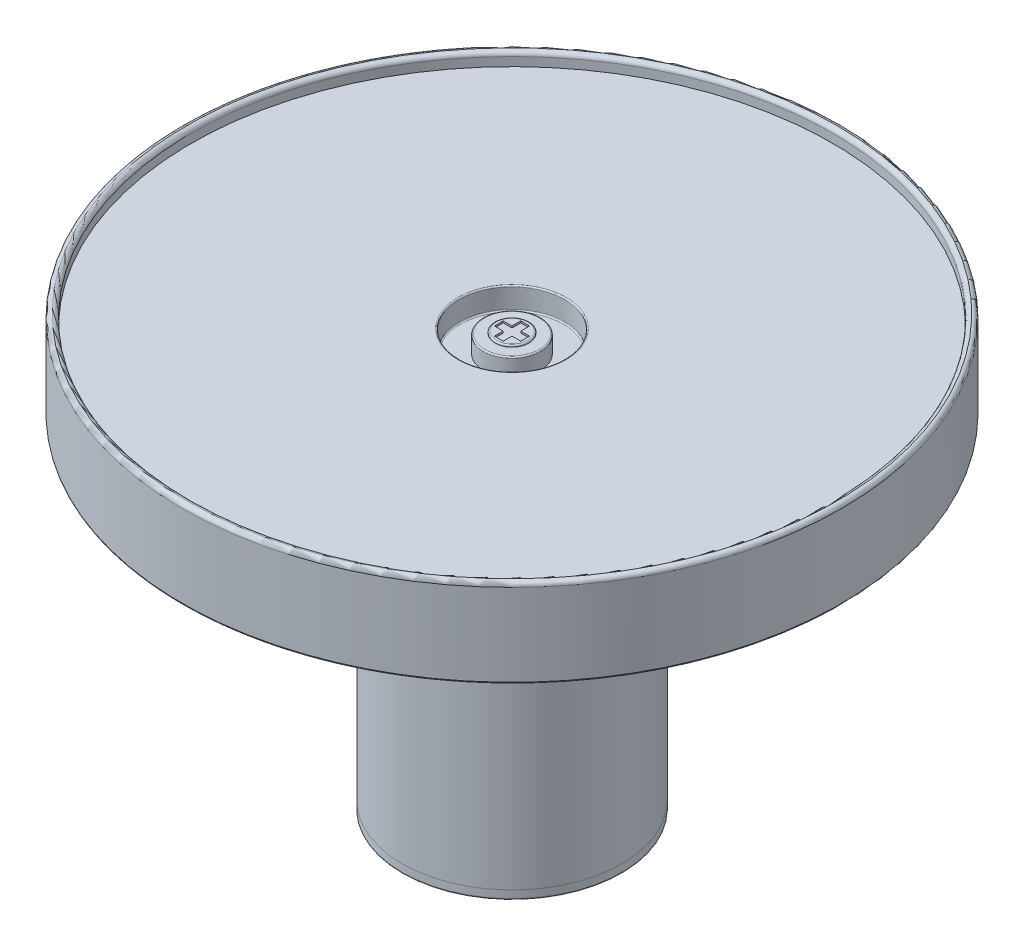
SolidWorks part; units mm, degrees
ref_plane "Alzado" through (0, 0, 0) normal (0, 0, 1) x (1, 0, 0)
ref_plane "Planta" through (0, 0, 0) normal (0, 1, 0) x (1, 0, 0)
ref_plane "Vista lateral" through (0, 0, 0) normal (1, 0, 0) x (0, 0, -1)
sketch "Croquis1" plane through (0, 0, 0) normal (0, 1, 0) x (1, 0, 0)
  circle A0 centre (0, 0) radius 25
extrude "Saliente-Extruir1" add sketch "Croquis1" along normal blind 2
sketch "Croquis2" plane through (0, 2, 0) normal (0, 1, 0) x (1, 0, 0)
  circle A0 centre (0, 0) radius 22.5
  circle A1 centre (0, 0) radius 18.5
extrude "Saliente-Extruir2" add sketch "Croquis2" along normal blind 5
sketch "Croquis3" plane through (0, 7, 0) normal (0, 1, 0) x (1, 0, 0)
  circle A0 centre (0, 0) radius 18.5
  circle A1 centre (0, 0) radius 20.5
extrude "Saliente-Extruir3" add sketch "Croquis3" along normal blind 6
sketch "Croquis4" plane through (0, 0, 0) normal (0, 0, 1) x (1, 0, 0)
  line L0 (-20.5, 13) -> (-22.1764, 13)
  line L1 (-22.3553, 12.7106) -> (-20.5211, 9.0422)
  line L2 (-20.5, 13) -> (-20.5, 7) construction
  line L4 (0, 0) -> (0, 19.3616)
  line L5 (-20.5, 13) -> (-20.5, 8.9528)
  arc A0 (-22.1764, 13) -> (-22.3553, 12.7106) centre (-22.1764, 12.8) ccw
  arc A1 (-20.5211, 9.0422) -> (-20.5, 8.9528) centre (-20.7, 8.9528) cw
  point P9 (-22.5, 13)
  point P12 (-20.5, 9)
  dimension "D3" = 0.2
  dimension "D1" = 2
  dimension "D2" = 4
revolve "Revolución1" add sketch "Croquis4" angle 360 about L4
sketch "Croquis5" plane through (0, 0, 0) normal (0, -1, 0) x (1, 0, 0)
  circle A0 centre (0, 0) radius 5
  circle A1 centre (13.5, 0) radius 2.5
  circle A2 centre (-13.5, 0) radius 2.5
  point P6 (0, 0)
extrude "Cortar-Extruir1" cut sketch "Croquis5" against normal blind 6
sketch "Croquis6" plane through (0, 2, 0) normal (0, 1, 0) x (1, 0, 0)
  circle A0 centre (0, 0) radius 25
  circle A1 centre (0, 0) radius 23
extrude "Saliente-Extruir4" add sketch "Croquis6" along normal blind 75 separate body
sketch "Croquis7" plane through (0, 77, 0) normal (0, 1, 0) x (1, 0, 0)
  circle A0 centre (0, 0) radius 25
  circle A1 centre (0, 0) radius 23
extrude "Saliente-Extruir5" add sketch "Croquis7" along normal blind 1 separate body
sketch "Croquis8" plane through (0, 78, 0) normal (0, 1, 0) x (1, 0, 0)
  circle A0 centre (0, 0) radius 71
extrude "Saliente-Extruir6" add sketch "Croquis8" along normal blind 1 separate body
sketch "Croquis9" plane through (0, 78, 0) normal (0, -1, 0) x (1, 0, 0)
  circle A0 centre (0, 0) radius 75
  circle A1 centre (0, 0) radius 71
extrude "Saliente-Extruir7" add sketch "Croquis9" against normal blind 1 separate body
sketch "Croquis10" plane through (0, 79, 0) normal (0, 1, 0) x (1, 0, 0)
  circle A0 centre (0, 0) radius 75
extrude "Saliente-Extruir8" add sketch "Croquis10" along normal blind 19
sketch "Croquis11" plane through (0, 98, 0) normal (0, 1, 0) x (1, 0, 0)
  circle A0 centre (0, 0) radius 73
extrude "Cortar-Extruir2" cut sketch "Croquis11" against normal blind 3
fillet "Redondeo1" radius 1 2 edges at (0, 98, 75) (0, 98, 73)
fillet "Redondeo2" radius 0.3 1 edges at (0, 78, -75)
fillet "Redondeo3" radius 0.3 1 edges at (0, 0, 25)
fillet "Redondeo4" radius 0.3 3 edges at (13.5, 0, -2.5) (0, 0, -5) (-13.5, 0, -2.5)
sketch "Croquis12" plane through (0, 95, 0) normal (0, 1, 0) x (1, 0, 0)
  circle A0 centre (0, 0) radius 12
extrude "Cortar-Extruir3" cut sketch "Croquis12" against normal blind 5
fillet "Redondeo5" radius 0.3 2 edges at (0, 90, 12) (0, 95, 12)
sketch "Croquis13" plane through (0, 90, 0) normal (0, 1, 0) x (1, 0, 0)
  circle A0 centre (0, 0) radius 6.5
  circle A1 centre (0, 0) radius 3.5
extrude "Saliente-Extruir9" add sketch "Croquis13" along normal blind 4 separate body
fillet "Redondeo6" radius 0.3 2 edges at (0, 94, 6.5) (0, 94, 3.5)
sketch "Croquis14" plane through (0, 94, 0) normal (0, 1, 0) x (1, 0, 0)
  circle A0 centre (0, 0) radius 3.8
extrude "Saliente-Extruir10" add sketch "Croquis14" along normal blind 0.5 draft 60
sketch "Croquis15" plane through (0, 94.5, 0) normal (0, 1, 0) x (1, 0, 0)
  line L0 (1, 1) -> (1, 3)
  line L1 (1, -3) -> (-1, -3)
  line L2 (1, -3) -> (1, -1)
  line L3 (1, 3) -> (-1, 3)
  line L4 (-1, -3) -> (-1, -1)
  line L7 (-3, -1) -> (-1, -1)
  line L8 (-3, -1) -> (-3, 1)
  line L9 (-3, 1) -> (-1, 1)
  line L10 (3, -1) -> (3, 1)
  line L17 (-1, 1) -> (-1, 3)
  line L18 (1, 1) -> (3, 1)
  line L19 (1, -1) -> (3, -1)
  point P0 (0, 0)
  point P5 (0, 0)
extrude "Cortar-Extruir4" cut sketch "Croquis15" against normal blind 0.4
fillet "Redondeo7" radius 0.3 1 edges at (0, 94.5, 4.666)
